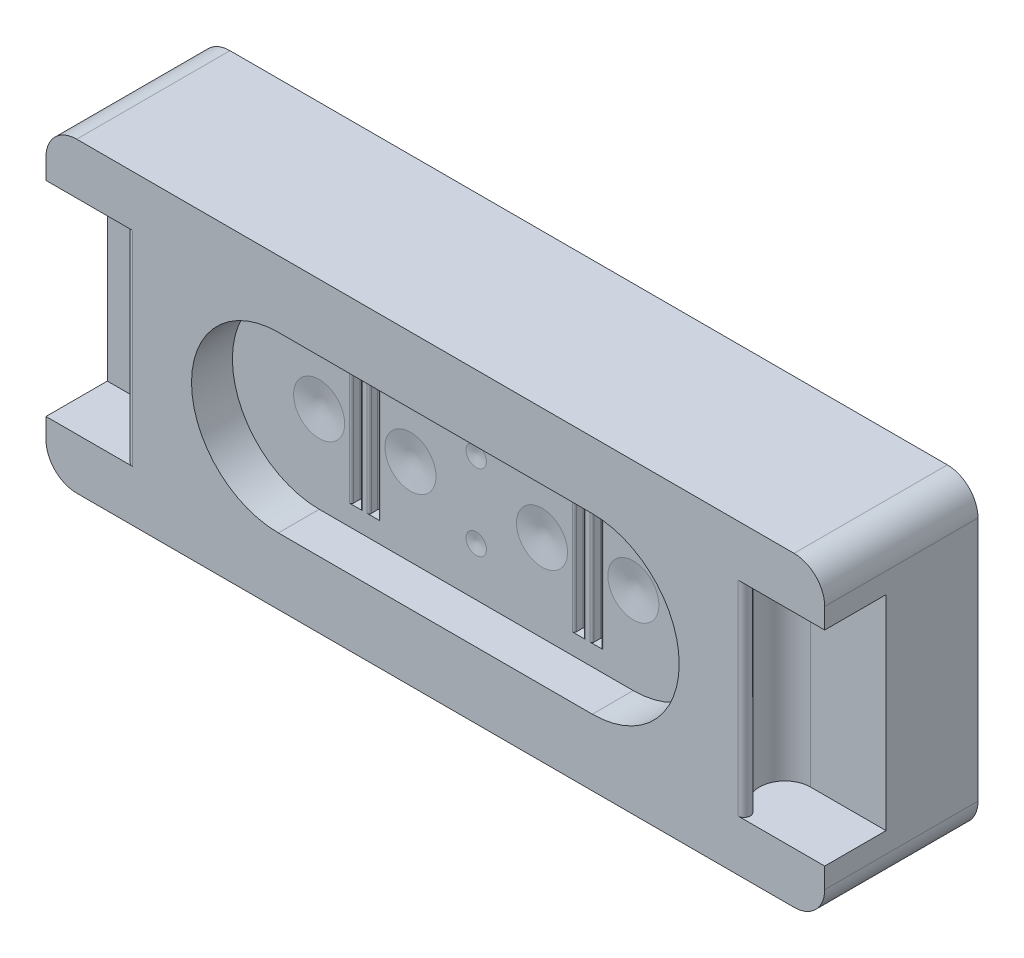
SolidWorks part; units mm, degrees
ref_plane "Front Plane" through (0, 0, 0) normal (0, 0, 1) x (1, 0, 0)
ref_plane "Top Plane" through (0, 0, 0) normal (0, 1, 0) x (1, 0, 0)
ref_plane "Right Plane" through (0, 0, 0) normal (1, 0, 0) x (0, 0, -1)
sketch "Sketch1" plane through (0, 0, 0) normal (0, 0, 1) x (1, 0, 0)
  line L0 (-9.6775, -3.81) -> (9.6775, 3.81) construction
  line L1 (-9.6775, 3.81) -> (9.6775, 3.81)
  line L2 (-9.6775, 3.81) -> (-9.6775, -3.81)
  line L3 (-9.6775, -3.81) -> (9.6775, -3.81)
  line L4 (9.6775, 3.81) -> (9.6775, -3.81)
  dimension "D1" = 19.355
  dimension "D2" = 7.62
extrude "Boss-Extrude1" add sketch "Sketch1" along normal blind 3.81
sketch "Sketch2" plane through (0, 0, 3.81) normal (0, 0, 1) x (1, 0, 0)
  line L0 (-3.9015, 0) -> (3.9015, 0) construction
  line L1 (-3.9015, 2.159) -> (3.9015, 2.159)
  line L2 (-3.9015, -2.159) -> (3.9015, -2.159)
  arc A0 (-3.9015, 2.159) -> (-3.9015, -2.159) centre (-3.9015, 0) ccw
  arc A1 (3.9015, -2.159) -> (3.9015, 2.159) centre (3.9015, 0) ccw
  point P3 (0, 0)
  dimension "D2" = 2.159
  dimension "D1" = 7.8031
extrude "Cut-Extrude1" cut sketch "Sketch2" against normal blind 1.016
sketch "Sketch3" plane through (0, 0, 2.794) normal (0, 0, 1) x (1, 0, 0)
  line L0 (0, 0.9461) -> (0, -0.9461) construction
  line L1 (0, 0) -> (-1.635, 0) construction
  line L2 (0, 0) -> (1.635, 0) construction
  line L3 (-3.905, 0) -> (-1.635, 0) construction
  line L4 (1.635, 0) -> (3.905, 0) construction
  circle A0 centre (-3.905, 0) radius 0.635
  circle A1 centre (-1.635, 0) radius 0.635
  circle A2 centre (0, 0) radius 0.254 construction
  circle A3 centre (1.635, 0) radius 0.635
  circle A4 centre (3.905, 0) radius 0.635
  circle A7 centre (0, 0.9461) radius 0.254
  circle A8 centre (0, -0.9461) radius 0.254
  dimension "D1" = 1.27
  dimension "D2" = 0.508
  dimension "D3" = 1
  dimension "D4" = 1
  dimension "D5" = 2
extrude "Cut-Extrude2" cut sketch "Sketch3" against normal through all
sketch "Sketch6" plane through (0, 0, 0) normal (0, 1, 0) x (1, 0, 0)
  line L0 (9.6775, -3.81) -> (-9.6775, -3.81) construction
  line L1 (-7.8011, -2.921) -> (0, 0) construction
  line L2 (0, 0) -> (7.8011, -2.921) construction
  line L3 (-7.8011, -3.556) -> (-7.8011, -3.81)
  line L4 (7.8011, -2.286) -> (9.6775, -2.286)
  line L5 (7.8011, -3.556) -> (7.8011, -3.81)
  line L6 (7.8011, -3.81) -> (9.6775, -3.81)
  line L7 (9.6775, -2.286) -> (9.6775, -3.81)
  line L8 (-7.8011, -2.286) -> (-9.6775, -2.286)
  line L10 (-7.8011, -3.81) -> (-9.6775, -3.81)
  line L11 (-9.6775, -2.286) -> (-9.6775, -3.81)
  arc A0 (-7.8011, -3.556) -> (-7.8011, -2.286) centre (-7.8011, -2.921) ccw
  arc A1 (7.8011, -2.286) -> (7.8011, -3.556) centre (7.8011, -2.921) ccw
  dimension "D1" = 15.6022
  dimension "D3" = 1.27
  dimension "D2" = 0.889
extrude "Cut-Extrude5" cut sketch "Sketch6" against normal mid plane 5.08
sketch "Sketch7" plane through (0, 2.54, 0) normal (0, -1, 0) x (1, 0, 0)
  line L0 (-9.6775, 3.81) -> (9.6775, 3.81) construction
  line L1 (-7.5229, 3.81) -> (-7.8011, 3.81)
  line L2 (-7.8011, 3.556) -> (-7.8011, 3.81)
  line L3 (7.5229, 3.81) -> (7.8011, 3.81)
  line L4 (7.8011, 3.81) -> (7.8011, 3.556)
  arc A0 (-7.5767, 3.515) -> (-7.5229, 3.81) centre (-7.5229, 3.6576) cw
  arc A1 (-7.8011, 2.286) -> (-7.8011, 3.556) centre (-7.8011, 2.921) ccw construction
  arc A2 (7.5229, 3.81) -> (7.5767, 3.515) centre (7.5229, 3.6576) cw
  arc A3 (7.8011, 3.556) -> (7.8011, 2.286) centre (7.8011, 2.921) ccw construction
  arc A4 (7.8011, 3.556) -> (7.5767, 3.515) centre (7.8011, 2.921) ccw
  arc A5 (-7.5767, 3.515) -> (-7.8011, 3.556) centre (-7.8011, 2.921) ccw
  dimension "D1" = 0.1524
extrude "Cut-Extrude6" cut sketch "Sketch7" along normal up to surface (5.08 mm away)
fillet "Fillet1" radius 0.762 4 edges at (-9.6775, -3.81, 1.905) (-9.6775, 3.81, 1.905) (9.6775, 3.81, 1.905) (9.6775, -3.81, 1.905)
sketch "Sketch8" plane through (0, 0, 2.794) normal (0, 0, 1) x (1, 0, 0)
  circle A0 centre (-3.905, 0) radius 0.635 construction
  circle A1 centre (-3.905, 0) radius 0.635
  circle A2 centre (-1.635, 0) radius 0.635 construction
  circle A3 centre (-1.635, 0) radius 0.635
  circle A5 centre (0, -0.9461) radius 0.254
  circle A6 centre (1.635, 0) radius 0.635 construction
  circle A7 centre (1.635, 0) radius 0.635
  circle A8 centre (3.905, 0) radius 0.635 construction
  circle A9 centre (3.905, 0) radius 0.635
  circle A10 centre (0, 0.9461) radius 0.254 construction
  circle A11 centre (0, 0.9461) radius 0.254
  circle A12 centre (0, -0.9461) radius 0.254 construction
extrude "Boss-Extrude2" add sketch "Sketch8" against normal up to surface (2.794 mm away) separate body
sketch "Sketch9" plane through (0, 0, 2.794) normal (0, 0, 1) x (1, 0, 0)
  circle A1 centre (-3.905, 0) radius 0.635
  circle A2 centre (-3.905, 0) radius 0.635
  circle A3 centre (-1.635, 0) radius 0.635
  circle A4 centre (-1.635, 0) radius 0.635
  circle A5 centre (1.635, 0) radius 0.635
  circle A6 centre (1.635, 0) radius 0.635
  circle A7 centre (3.905, 0) radius 0.635
  circle A8 centre (3.905, 0) radius 0.635
  dimension "D1" = 0
  dimension "D2" = 0
  dimension "D3" = 0
  dimension "D4" = 0
extrude "Cut-Extrude7" cut sketch "Sketch9" against normal blind 2.54 draft 80
sketch "Sketch10" plane through (0, 0, 2.794) normal (0, 0, 1) x (1, 0, 0)
  circle A1 centre (0, -0.9461) radius 0.254
  circle A2 centre (0, -0.9461) radius 0.254
  dimension "D1" = 0
extrude "Cut-Extrude8" cut sketch "Sketch10" against normal blind 2.54 draft 80
sketch "Sketch11" plane through (0, 0, 2.794) normal (0, 0, 1) x (1, 0, 0)
  circle A1 centre (0, 0.9461) radius 0.254
  circle A2 centre (0, 0.9461) radius 0.254
  dimension "D1" = 0
extrude "Cut-Extrude9" cut sketch "Sketch11" against normal blind 2.54 draft 80
sketch "Sketch12" plane through (0, 0, 2.794) normal (0, 0, 1) x (1, 0, 0)
  circle A1 centre (3.905, 0) radius 0.635
  circle A2 centre (3.905, 0) radius 0.635
  dimension "D1" = 0
extrude "Cut-Extrude10" cut sketch "Sketch12" against normal blind 2.54 draft 80
sketch "Sketch13" plane through (0, 0, 2.794) normal (0, 0, 1) x (1, 0, 0)
  line L0 (-3.905, 0) -> (-3.1015, 0) construction
  line L1 (-3.1015, -1.651) -> (-2.8805, -1.651)
  line L2 (-3.1015, -1.651) -> (-3.1015, 1.651)
  line L3 (-3.1015, 1.651) -> (-2.8805, 1.651)
  line L4 (-2.8805, -1.651) -> (-2.8805, 1.651)
  line L5 (-2.6595, -1.651) -> (-2.4385, -1.651)
  line L6 (-2.6595, -1.651) -> (-2.6595, 1.651)
  line L7 (-2.6595, 1.651) -> (-2.4385, 1.651)
  line L8 (-2.4385, -1.651) -> (-2.4385, 1.651)
  line L9 (2.4385, -1.651) -> (2.6595, -1.651)
  line L10 (2.4385, -1.651) -> (2.4385, 1.651)
  line L11 (2.4385, 1.651) -> (2.6595, 1.651)
  line L12 (2.6595, -1.651) -> (2.6595, 1.651)
  line L13 (2.8805, -1.651) -> (3.1015, -1.651)
  line L14 (2.8805, -1.651) -> (2.8805, 1.651)
  line L15 (2.8805, 1.651) -> (3.1015, 1.651)
  line L16 (3.1015, -1.651) -> (3.1015, 1.651)
  line L17 (-2.4385, 0) -> (-1.635, 0) construction
  line L18 (1.635, 0) -> (2.4385, 0) construction
  line L19 (3.1015, 0) -> (3.905, 0) construction
  line L20 (-2.8805, 1.651) -> (-2.6595, 1.651) construction
  line L21 (2.6595, 1.651) -> (2.8805, 1.651) construction
  line L22 (3.9015, 2.159) -> (-3.9015, 2.159) construction
  dimension "D1" = 0.221
  dimension "D2" = 0.508
extrude "Cut-Extrude11" cut sketch "Sketch13" against normal blind 0.26
fillet "Fillet2" radius 0.0508 16 edges at (2.4385, 0, 2.534) (2.8805, 0, 2.534) (3.1015, 0, 2.794) (3.1015, 0, 2.534) (2.8805, 0, 2.794) (2.6595, 0, 2.794) (2.6595, 0, 2.534) (2.4385, 0, 2.794) (-2.4385, 0, 2.534) (-2.8805, 0, 2.534) (-2.8805, 0, 2.794) (-2.4385, 0, 2.794) (-2.6595, 0, 2.534) (-2.6595, 0, 2.794) (-3.1015, 0, 2.534) (-3.1015, 0, 2.794)
